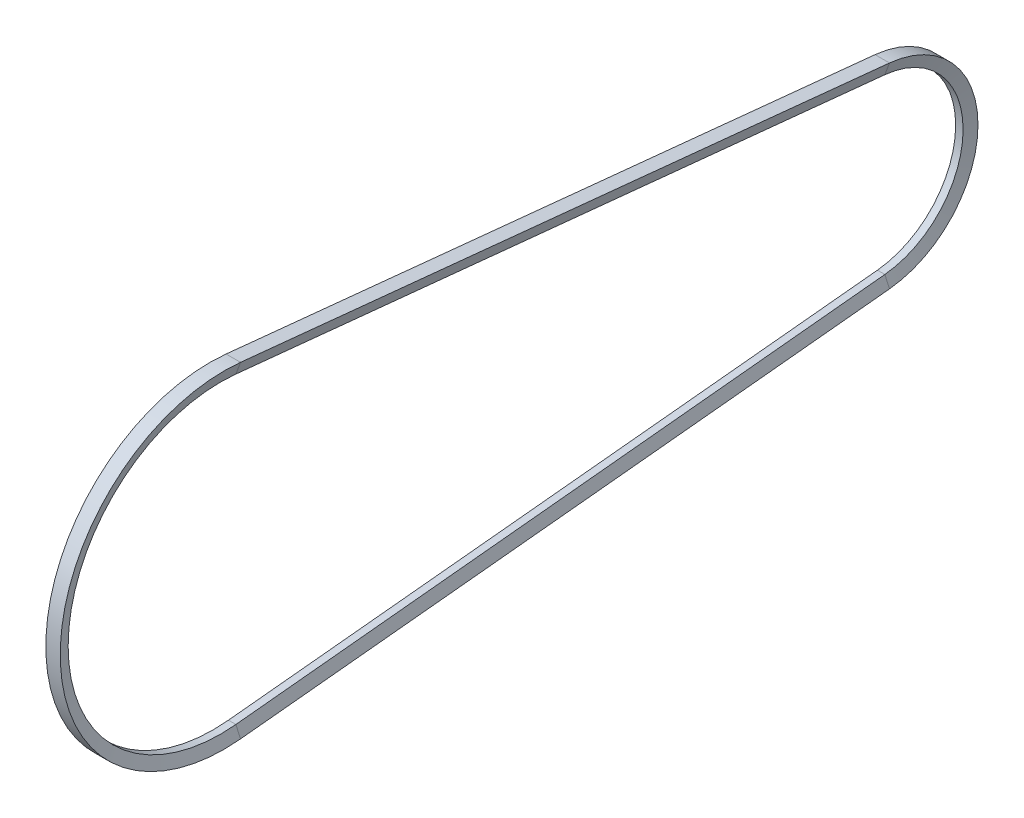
SolidWorks part; units mm, degrees
ref_plane "前视基准面" through (0, 0, 0) normal (0, 0, 1) x (1, 0, 0)
ref_plane "上视基准面" through (0, 0, 0) normal (0, 1, 0) x (1, 0, 0)
ref_plane "右视基准面" through (0, 0, 0) normal (1, 0, 0) x (0, 0, -1)
sketch "草图1" plane through (0, 0, 0) normal (1, 0, 0) x (0, 0, -1)
  line L0 (12.5, 124.3734) -> (507.5, 74.6241)
  line L1 (12.5, -124.3734) -> (507.5, -74.6241)
  line L2 (0, 0) -> (500, 0) construction
  arc A0 (12.5, 124.3734) -> (12.5, -124.3734) centre (0, 0) ccw
  arc A1 (507.5, -74.6241) -> (507.5, 74.6241) centre (500, 0) ccw
  dimension "D1" = 125
  dimension "D2" = 75
  dimension "D3" = 500
sketch "草图2" plane through (0, 0, 0) normal (0, 0, 1) x (1, 0, 0)
  line L0 (-5.5, 125) -> (5.5, 125)
  line L1 (5.5, 125) -> (2.8401, 116.3)
  line L2 (2.8401, 116.3) -> (-2.8401, 116.3)
  line L3 (-2.8401, 116.3) -> (-5.5, 125)
  line L4 (0, 116.3) -> (0, 125) construction
  line L5 (0, -125) -> (0, 125) construction
  dimension "D1" = 11
  dimension "D2" = 8.7
  dimension "D3" = 34
sweep "扫描1" add profiles "草图2" path "草图1"
equation "\"D3@草图1\" = \"D1@距离1@实心轮_实心轮.Assembly\""
equation "\"D3@草图1\" = \"D1@距离1@实心轮_孔板轮.Assembly\""
equation "\"D3@草图1\" = \"D1@距离1@实心轮_辐板轮.Assembly\""
equation "\"D3@草图1\" = \"D1@距离1@孔板轮_孔板轮.Assembly\""
equation "\"D3@草图1\" = \"D1@距离1@孔板轮_辐板轮.Assembly\""
equation "\"D3@草图1\" = \"D1@距离1@辐板轮_辐板轮.Assembly\""
equation "\"D1@草图2\" = \"bd@草图1@小带轮_实心轮.Part\" "
equation "\"D1@草图2\" = \"bd@草图1@大带轮_孔板轮.Part\" "
equation "\"D1@草图2\" = \"bd@草图1@大带轮_辐板轮.Part\" "
equation "\"D2@草图2\" = \"hf@草图1@小带轮_实心轮.Part\" "
equation "\"D2@草图2\" = \"hf@草图1@大带轮_辐板轮.Part\" "
equation "\"D2@草图2\" = \"hf@草图1@大带轮_孔板轮.Part\" "
equation "\"D3@草图2\" = \"槽轮角@草图1@小带轮_实心轮.Part\" "
equation "\"D3@草图2\" = \"槽轮角@草图1@大带轮_辐板轮.Part\" "
equation "\"D3@草图2\" = \"槽轮角@草图1@大带轮_孔板轮.Part\" "
equation "\"D2@草图1\" = \"dd@草图1@小带轮_实心轮.Part\"/2"
equation " \"D2@草图1\" = \"dd@草图1@小带轮_孔板轮.Part\"/2"
equation "\"D2@草图1\" = \"dd@草图1@小带轮_辐板轮.Part\"/2  "
equation "\"D1@草图1\" = \"dd@草图1@大带轮_实心轮.Part\" /2"
equation "\"D1@草图1\" = \"dd@草图1@大带轮_孔板轮.Part\" /2"
equation "\"D1@草图1\" = \"dd@草图1@大带轮_辐板轮.Part\" /2"
